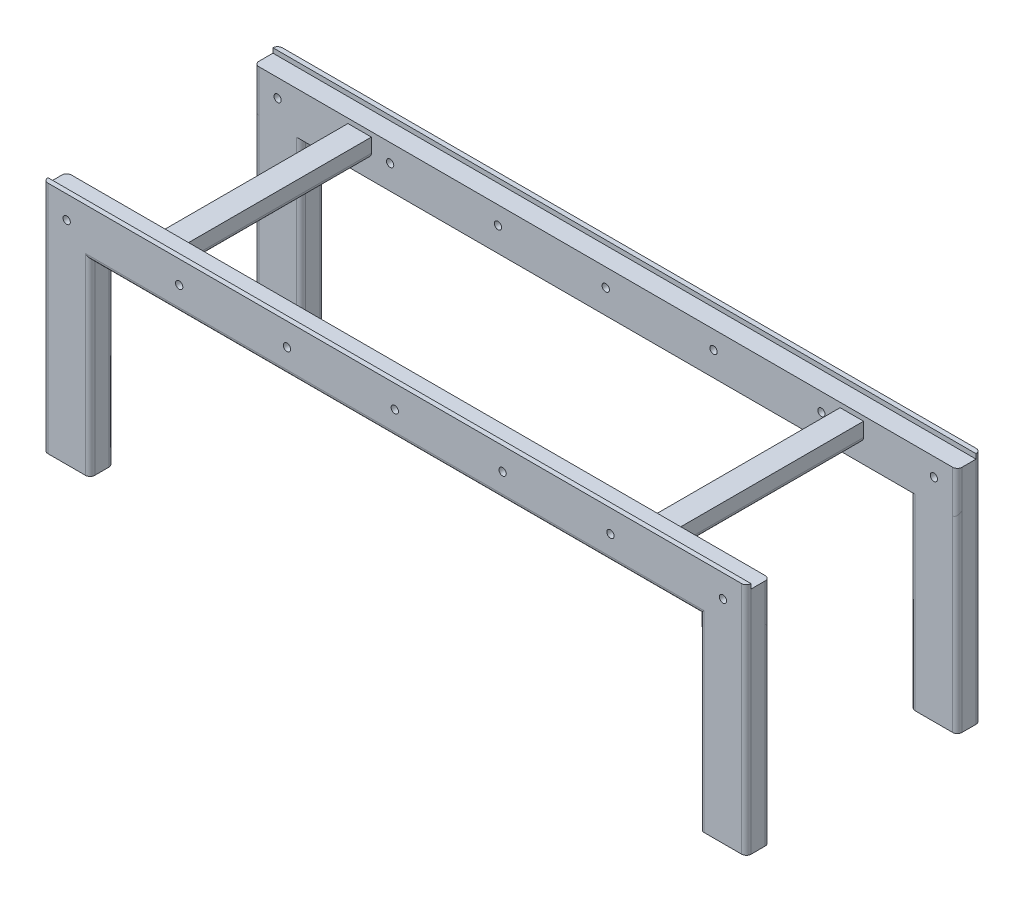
SolidWorks part; units mm, degrees
ref_plane "Alzado" through (0, 0, 0) normal (0, 0, 1) x (1, 0, 0)
ref_plane "Planta" through (0, 0, 0) normal (0, 1, 0) x (1, 0, 0)
ref_plane "Vista lateral" through (0, 0, 0) normal (1, 0, 0) x (0, 0, -1)
sketch "Croquis1" plane through (0, 0, 0) normal (0, 1, 0) x (1, 0, 0)
  line L1 (-750, 250) -> (750, 250)
  line L2 (-750, 250) -> (-750, -250)
  line L3 (-750, -250) -> (750, -250)
  line L4 (750, 250) -> (750, -250)
  line L5 (-750, 250) -> (750, -250) construction
  line L6 (-750, -250) -> (750, 250) construction
  point P0 (0, 0)
  dimension "D1" = 1500
  dimension "D2" = 500
extrude "Saliente-Extruir1" add sketch "Croquis1" along normal blind 500 contours L2 L1 L4 L3
sketch "Croquis2" plane through (0, 0, 0) normal (0, 0, 1) x (1, 0, 0)
  line L0 (0, 0) -> (0, 400) construction
  line L1 (-750, 0) -> (750, 0) construction
  line L2 (-650, 400) -> (650, 400)
  line L3 (-650, 400) -> (-650, 0)
  line L4 (-650, 0) -> (650, 0)
  line L5 (650, 400) -> (650, 0)
  line L6 (-650, 400) -> (650, 0) construction
  line L7 (-650, 0) -> (650, 400) construction
  point P3 (0, 200)
  dimension "D1" = 400
  dimension "D2" = 1300
extrude "Cortar-Extruir1" cut sketch "Croquis2" against normal through all both and the other way through all contours L3 L2 L5 L4
sketch "Croquis3" plane through (0, 0, 0) normal (1, 0, 0) x (0, 0, -1)
  line L0 (0, 0) -> (0, 400) construction
  line L1 (250, 0) -> (-250, 0) construction
  line L2 (-200, 400) -> (200, 400)
  line L3 (-200, 400) -> (-200, 0)
  line L4 (-200, 0) -> (200, 0)
  line L5 (200, 400) -> (200, 0)
  line L6 (-200, 400) -> (200, 0) construction
  line L7 (-200, 0) -> (200, 400) construction
  point P3 (0, 200)
  dimension "D1" = 400
  dimension "D2" = 400
extrude "Cortar-Extruir2" cut sketch "Croquis3" against normal through all both and the other way through all contours L3 L2 L5 L4
sketch "Croquis4" plane through (0, 0, 0) normal (1, 0, 0) x (0, 0, -1)
  line L0 (0, 0) -> (0, 500) construction
  line L1 (250, 500) -> (-250, 500) construction
  line L3 (-240, 510) -> (240, 510)
  line L4 (-240, 510) -> (-240, 490)
  line L5 (-240, 490) -> (240, 490)
  line L6 (240, 510) -> (240, 490)
  line L7 (-240, 510) -> (240, 490) construction
  line L8 (-240, 490) -> (240, 510) construction
  dimension "D1" = 20
  dimension "D2" = 480
extrude "Cortar-Extruir3" cut sketch "Croquis4" along normal through all both and the other way through all
fillet "Redondeo1" radius 10 15 edges at (-650, 200, -250) (-650, 200, -200) (-650, 200, 250) (-650, 200, 200) (750, 200, 200) (650, 200, 200) (750, 200, -200) (650, 200, -250) (0, 400, -250) (750, 400, 0) (750, 250, -250) (-750, 400, 0) (-750, 250, -250) (750, 250, 250) (-750, 250, 250)
fillet "Redondeo2" radius 10 2 edges at (-750, 205, 200) (-750, 205, -200)
sketch "Croquis5" plane through (0, 0, 0) normal (0, 1, 0) x (1, 0, 0)
  line L0 (-750, 0) -> (750, 0) construction
  line L1 (-750, -240) -> (-750, 240) construction
  line L2 (750, -240) -> (750, 240) construction
  line L3 (-650, 0) -> (-650, -154.5157) construction
  line L4 (-650, 132.6158) -> (-650, 0) construction
  line L5 (-650, 0) -> (-650, 103.416) construction
  line L7 (-550, 200) -> (-750, 200)
  line L8 (-550, 200) -> (-550, -200)
  line L9 (-550, -200) -> (-750, -200)
  line L10 (-750, 200) -> (-750, -200)
  line L11 (-550, 200) -> (-750, -200) construction
  line L12 (-550, -200) -> (-750, 200) construction
  dimension "D1" = 400
  dimension "D2" = 200
extrude "Cortar-Extruir12" cut sketch "Croquis5" along normal blind 500 contours L8 L7 L10 L9
sketch "Croquis6" plane through (0, 0, 0) normal (0, 1, 0) x (1, 0, 0)
  line L0 (750, 0) -> (0, 0) construction
  line L1 (750, -240) -> (750, 240) construction
  line L2 (650, 0) -> (650, 240) construction
  line L3 (750, 240) -> (-750, 240) construction
  line L4 (650, 0) -> (650, -217.7819) construction
  line L6 (550, 200) -> (750, 200)
  line L7 (550, 200) -> (550, -200)
  line L8 (550, -200) -> (750, -200)
  line L9 (750, 200) -> (750, -200)
  line L10 (550, 200) -> (750, -200) construction
  line L11 (550, -200) -> (750, 200) construction
  dimension "D1" = 400
  dimension "D2" = 200
extrude "Cortar-Extruir13" cut sketch "Croquis6" along normal blind 500 contours L7 L6 L9 L8
sketch "Croquis7" plane through (0, 0, 0) normal (0, 1, 0) x (1, 0, 0)
  line L1 (-500, 200) -> (500, 200)
  line L2 (-500, 200) -> (-500, -200)
  line L3 (-500, -200) -> (500, -200)
  line L4 (500, 200) -> (500, -200)
  line L5 (-500, 200) -> (500, -200) construction
  line L6 (-500, -200) -> (500, 200) construction
  point P0 (0, 0)
  dimension "D1" = 400
  dimension "D2" = 1000
extrude "Cortar-Extruir14" cut sketch "Croquis7" along normal blind 500
fillet "Redondeo3" radius 10 2 edges at (650, 200, 250) (-5, 400, 250)
hole_wizard "Taladro de margen para #01" positions "Croquis9" profile "Croquis8" hole size "#0" standard "Ansi Inch"
sketch "Croquis9" plane through (0, 0, 250) normal (0, 0, 1) x (1, 0, 0)
  point P0 (-510.9967, 445.8821)
sketch "Croquis8" plane through (-510.9967, 445.8821, 250) normal (1, 0, 0) x (0, -1, 0)
  line L0 (0, 0) -> (0, 500)
  line L1 (0, 500) -> (0.889, 500)
  line L2 (0.889, 500) -> (0.889, 0)
  line L5 (0.889, 0) -> (0, 0)
  line L11 (0, -6.35) -> (0, 107.95) construction
  dimension "Diámetro de taladro hasta el siguiente" = 1.778
  dimension "Profundidad de taladro hasta el siguiente" = 500
sketch "Croquis10" [suppressed] plane through (0, 0, 0) normal (0, 0, 1) x (1, 0, 0)
  point P0 (-700, 449.1592)
  point P1 (-439.3574, 449.1592)
  point P2 (-238.9911, 449.1592)
  point P3 (-43.4529, 449.1592)
  point P4 (173.8117, 449.1592)
  point P5 (371.7639, 449.1592)
  point P6 (540.7475, 449.1592)
  point P7 (700, 449.1592)
  dimension "D1" = 700
  dimension "D2" = 700
  dimension "D3" = 260.6426
hole_wizard "Taladro roscado M181" positions "Croquis16" profile "Croquis17" tap size "M18" standard "ISO"
sketch "Croquis16" plane through (0, 0, 250) normal (0, 0, 1) x (1, 0, 0)
  point P0 (-700, 451.6363)
  point P2 (-460, 451.6363)
  point P4 (-230, 451.6363)
  point P6 (0, 451.6363)
  point P8 (230, 451.6363)
  point P10 (460, 451.6363)
  point P12 (700, 451.6363)
  dimension "D1" = 700
  dimension "D2" = 240
  dimension "D3" = 230
  dimension "D4" = 230
  dimension "D5" = 230
  dimension "D6" = 230
  dimension "D7" = 240
sketch "Croquis17" plane through (-700, 451.6363, 250) normal (1, 0, 0) x (0, -1, 0)
  line L0 (0, 0) -> (0, 500)
  line L1 (0, 500) -> (7.75, 500)
  line L2 (7.75, 500) -> (7.75, 0)
  line L5 (7.75, 0) -> (0, 0)
  line L11 (0, -6.35) -> (0, 107.95) construction
  dimension "Diámetro mayor de rosca" = 15.5
  dimension "Profundidad de perforador para roscar hasta el siguiente" = 500
sketch "Croquis18" plane through (0, 0, 0) normal (1, 0, 0) x (0, 0, -1)
  line L0 (0, 0) -> (0, 485) construction
  line L1 (-200, 490) -> (200, 490) construction
  line L2 (200, 480) -> (-200, 480)
  line L3 (200, 480) -> (200, 490)
  line L4 (200, 490) -> (-200, 490)
  line L5 (-200, 480) -> (-200, 490)
  line L6 (200, 480) -> (-200, 490) construction
  line L7 (200, 490) -> (-200, 480) construction
  dimension "D1" = 10
  dimension "D2" = 400
extrude "Cortar-Extruir16" cut sketch "Croquis18" against normal through all and the other way through all
sketch "Croquis19" plane through (550, 0, 0) normal (1, 0, 0) x (0, 0, -1)
  line L0 (0, 400) -> (0, 473.2681) construction
  line L2 (200, 400) -> (-200, 400) construction
  line L3 (-200, 440) -> (200, 440)
  line L4 (-200, 440) -> (-200, 400)
  line L5 (-200, 400) -> (200, 400)
  line L6 (200, 440) -> (200, 400)
  line L7 (-200, 440) -> (200, 400) construction
  line L8 (-200, 400) -> (200, 440) construction
  point P4 (0, 420)
  dimension "D1" = 400
  dimension "D2" = 40
extrude "Cortar-Extruir17" cut sketch "Croquis19" against normal through all both and the other way through all
fillet "Redondeo5" radius 10 4 edges at (750, 450, -200) (750, 450, 200) (-750, 450, 200) (-750, 450, -200)
fillet "Redondeo6" radius 10 1 edges at (650, 200, -200)
fillet "Redondeo7" radius 10 4 edges at (-500, 440, 0) (-550, 440, 0) (550, 440, 0) (500, 440, 0)
